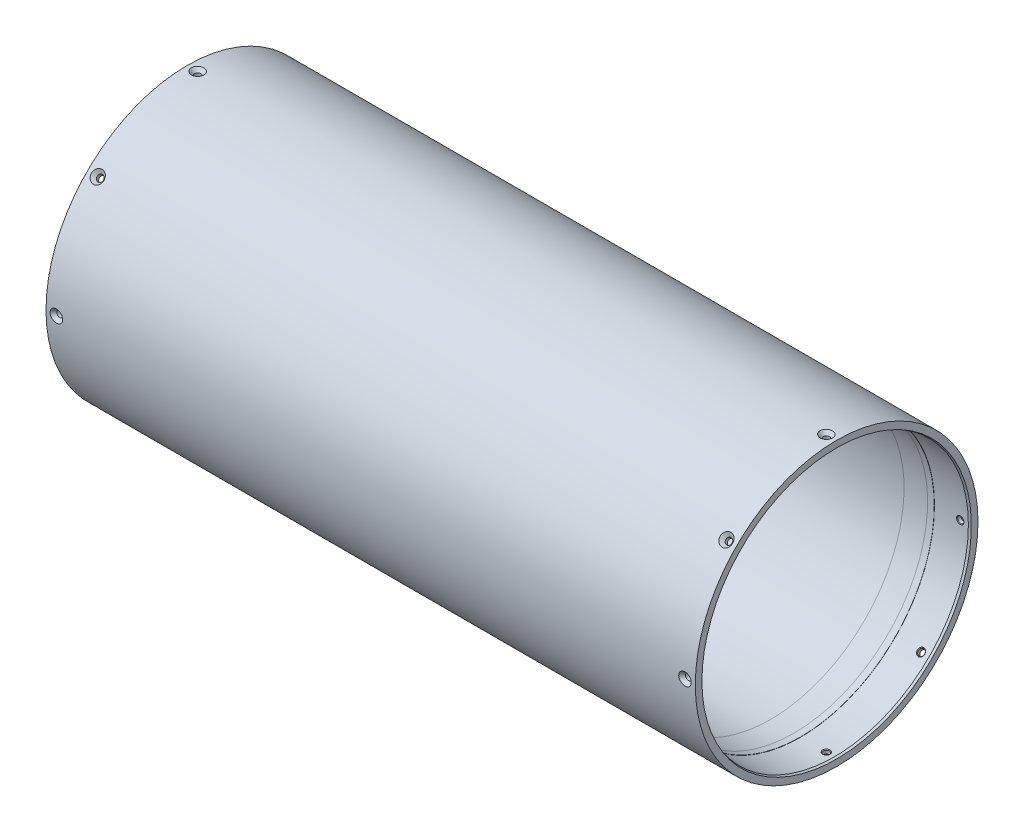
SolidWorks part; units mm, degrees
ref_plane "Front" through (0, 0, 0) normal (0, 0, 1) x (1, 0, 0)
ref_plane "Top" through (0, 0, 0) normal (0, 1, 0) x (1, 0, 0)
ref_plane "Right" through (0, 0, 0) normal (1, 0, 0) x (0, 0, -1)
ref_plane "Plane1" through (0, 152.4, 0) normal (0, 1, 0) x (1, 0, 0)
sketch "Sketch1" plane through (0, 0, 0) normal (0, 0, 1) x (1, 0, 0)
  line L0 (0, 0) -> (41.9184, 0) construction
  line L1 (-350.7994, 152.4) -> (349.25, 152.4)
  line L2 (349.25, 144.145) -> (-350.7994, 144.145)
  line L3 (349.25, -144.145) -> (-350.7994, -144.145) construction
  line L4 (-350.7994, -152.4) -> (349.25, -152.4) construction
  line L6 (-350.7994, 144.145) -> (-350.7994, 152.4)
  line L7 (349.25, 152.4) -> (349.25, 144.145)
  dimension "D1" = 304.8
  dimension "D2" = 8.255
  dimension "D3" = 288.29
  dimension "D4" = 349.25
  dimension "D5" = 700.0494
revolve "Revolve1" add sketch "Sketch1" angle 360 about L0
sketch "Sketch4" plane through (-350.7994, 0, 0) normal (-1, 0, 0) x (0, 0, 1)
  circle A0 centre (0, 0) radius 144.399
  dimension "D1" = 288.798
extrude "o-ring" cut sketch "Sketch4" against normal blind 38.8938
sketch "Sketch5" plane through (349.25, 0, 0) normal (1, 0, 0) x (0, 0, -1)
  circle A0 centre (0, 0) radius 144.399
  dimension "D1" = 288.798
extrude "o-ring2" cut sketch "Sketch5" against normal blind 38.8938
chamfer "Chamfer1" distance 2.3685 angle 20 1 edges at (349.25, 0, -144.399)
chamfer "Chamfer2" distance 2.3685 angle 20 1 edges at (-350.7994, 0, 144.399)
sketch "Sketch3" plane through (0, 0, 0) normal (0, 0, 1) x (1, 0, 0)
  line L0 (303.2125, 268.0482) -> (303.2125, -228.0907)
  line L1 (349.25, -152.4) -> (349.25, 152.4) construction
  line L2 (277.8125, 268.0482) -> (277.8125, -228.0907)
  line L3 (303.2125, 268.0482) -> (277.8125, 268.0482)
  line L4 (277.8125, -228.0907) -> (303.2125, -228.0907)
  dimension "D1" = 46.0375
  dimension "D2" = 25.4
sketch "Sketch2" plane through (0, 0, 0) normal (0, 0, 1) x (1, 0, 0)
  line L0 (-304.7619, -277.0979) -> (-304.7619, 322.1404)
  line L1 (-350.7994, 145.2611) -> (-350.7994, -145.2611) construction
  line L2 (-304.7619, 322.1404) -> (-279.3619, 322.1404)
  line L3 (-279.3619, 322.1404) -> (-279.3619, -277.0979)
  line L4 (-304.7619, -277.0979) -> (-279.3619, -277.0979)
  dimension "D1" = 46.0375
  dimension "D2" = 25.4
sketch "Sketch6" [suppressed] plane through (0, 0, 0) normal (1, 0, 0) x (0, 0, -1)
  ellipse E0 centre (0, 0) end of major axis (0, -153.1239) minor radius 152.2476
  dimension "D1" = 306.2478
  dimension "D2" = 304.4952
sketch "Sketch7" [suppressed] plane through (0, 0, 0) normal (0, 0, 1) x (1, 0, 0)
  line L1 (-615.728, 241.9474) -> (584.6323, 241.9474)
  line L2 (-615.728, 241.9474) -> (-615.728, -271.837)
  line L3 (-615.728, -271.837) -> (584.6323, -271.837)
  line L4 (584.6323, 241.9474) -> (584.6323, -271.837)
extrude "Section" [suppressed] cut sketch "Sketch7" along normal through all
hole_wizard "CSK for 1/4 Flat Head Socket Cap Screw1" positions "Sketch9" profile "Sketch8" countersink size "1/4" standard "ANSI Inch"
sketch "Sketch9" plane through (0, 152.4, 0) normal (0, 1, 0) x (1, 0, 0)
  line L0 (-350.7994, 152.4) -> (-350.7994, -152.4) construction
  line L1 (349.25, -152.4) -> (349.25, 152.4) construction
  point P0 (-339.6869, 0)
  point P8 (338.1375, 0)
  dimension "D1" = 11.1125
  dimension "D2" = 11.1125
sketch "Sketch8" plane through (-339.6869, 152.4, 0) normal (1, 0, 0) x (0, 0, 1)
  line L0 (0, 0) -> (0, 8.001)
  line L1 (0, 8.001) -> (4.0132, 8.001)
  line L2 (3.3782, 7.366) -> (3.3782, 3.8716)
  line L3 (3.3782, 3.8716) -> (6.7437, 0)
  line L5 (6.7437, 0) -> (0, 0)
  line L6 (-3.3782, 3.8716) -> (-6.7437, 0) construction
  line L7 (4.0132, 8.001) -> (3.3782, 7.366)
  line L8 (-4.0132, 8.001) -> (-3.3782, 7.366) construction
  line L11 (0, -6.35) -> (0, 107.95) construction
  dimension "Thru Hole Dia." = 6.7564
  dimension "Thru Hole Depth" = 8.001
  dimension "Near C'Sink Dia." = 13.4874
  dimension "Near C'Sink Angle" = 82
  dimension "Far C'Sink Dia." = 8.0264
  dimension "Far C'Sink Angle" = 90
pattern_circular "CirPattern1" count 8 over 360 about axis through (0, 0, 0) along (-1, 0, 0) of "CSK for 1/4 Flat Head Socket Cap Screw1"
equation "\"Buoyancy\"= \"SW-Volume\" * ( \"SW-Density\" - .037062 )"
